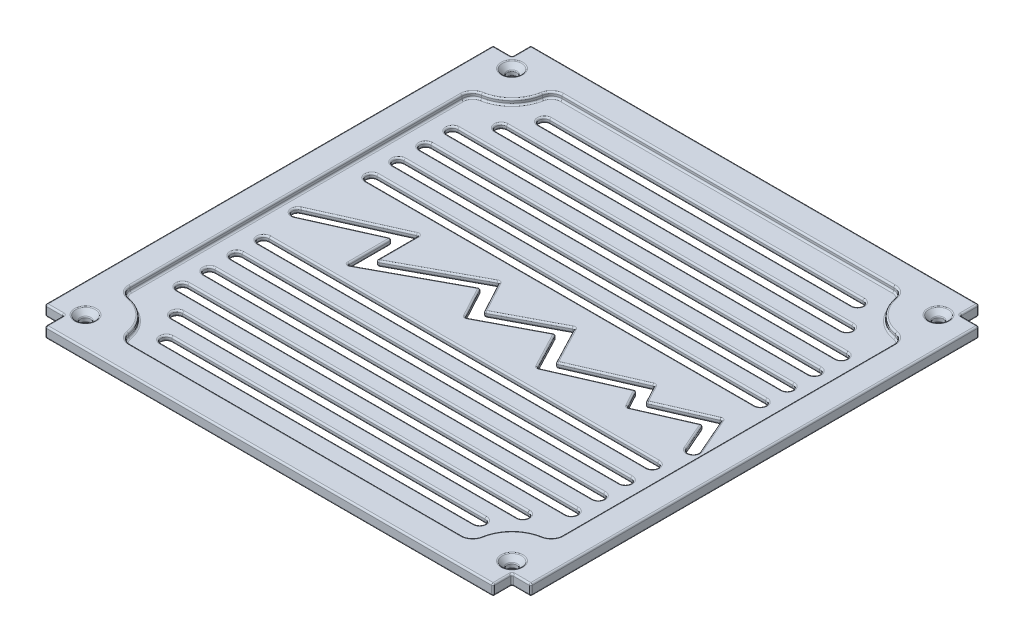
SolidWorks part; units mm, degrees
ref_plane "Front Plane" through (0, 0, 0) normal (0, 0, 1) x (1, 0, 0)
ref_plane "Top Plane" through (0, 0, 0) normal (0, 1, 0) x (1, 0, 0)
ref_plane "Right Plane" through (0, 0, 0) normal (1, 0, 0) x (0, 0, -1)
imported_body "Stock-cubesat - Master-1"
sketch "Sketch1" plane through (0, 50, 0) normal (0, 1, 0) x (1, 0, 0)
  line L1 (32.6181, -40) -> (-32.6181, -40)
  line L2 (40, -32.6181) -> (40, 32.6181)
  line L3 (32.6181, 40) -> (-32.6181, 40)
  line L4 (-40, -32.6181) -> (-40, 32.6181)
  line L5 (34.621, -34.621) -> (-34.621, 34.621) construction
  line L6 (34.621, 34.621) -> (-34.621, -34.621) construction
  arc A1 (32.6181, 40) -> (40, 32.6181) centre (39.5, 39.5) ccw
  circle A2 centre (-39.5, 39.5) radius 6.9
  arc A3 (-40, 32.6181) -> (-32.6181, 40) centre (-39.5, 39.5) ccw
  arc A4 (40, -32.6181) -> (32.6181, -40) centre (39.5, -39.5) ccw
  arc A5 (-32.6181, -40) -> (-40, -32.6181) centre (-39.5, -39.5) ccw
  point P0 (0, 0)
  point P18 (0, 0)
  dimension "D1" = 5
  dimension "D2" = 4
extrude "Cut-Extrude1" cut sketch "Sketch1" against normal blind 1
fillet "Fillet1" radius 2 8 edges at (-32.6181, 49.5, 40) (-40, 49.5, 32.6181) (40, 49.5, 32.6181) (32.6181, 49.5, 40) (40, 49.5, -32.6181) (32.6181, 49.5, -40) (-40, 49.5, -32.6181) (-32.6181, 49.5, -40)
sketch "Sketch2" plane through (0, 49, 0) normal (0, 1, 0) x (1, 0, 0)
  line L0 (0, 0) -> (-15.888, 0) construction
  line L1 (29, 35) -> (-29, 35) construction
  line L2 (29, 34) -> (-29, 34)
  line L3 (29, 36) -> (-29, 36)
  line L4 (32, 30) -> (-32, 30) construction
  line L5 (32, 29) -> (-32, 29)
  line L6 (32, 31) -> (-32, 31)
  line L7 (36, 25) -> (-36, 25) construction
  line L8 (36, 24) -> (-36, 24)
  line L9 (36, 26) -> (-36, 26)
  line L10 (36, 20) -> (-36, 20) construction
  line L11 (36, 19) -> (-36, 19)
  line L12 (36, 21) -> (-36, 21)
  line L13 (36, 15) -> (-36, 15) construction
  line L14 (36, 14) -> (-36, 14)
  line L15 (36, 16) -> (-36, 16)
  line L16 (36, 10) -> (-36, 10) construction
  line L17 (36, 9) -> (-36, 9)
  line L18 (36, 11) -> (-36, 11)
  line L19 (36, -10) -> (-36, -10) construction
  line L20 (36, -9) -> (-36, -9)
  line L21 (36, -11) -> (-36, -11)
  line L28 (36, -15) -> (-36, -15) construction
  line L29 (36, -14) -> (-36, -14)
  line L30 (36, -16) -> (-36, -16)
  line L31 (36, -20) -> (-36, -20) construction
  line L32 (36, -19) -> (-36, -19)
  line L33 (36, -21) -> (-36, -21)
  line L34 (36, -25) -> (-36, -25) construction
  line L35 (36, -24) -> (-36, -24)
  line L36 (36, -26) -> (-36, -26)
  line L37 (32, -30) -> (-32, -30) construction
  line L38 (32, -29) -> (-32, -29)
  line L39 (32, -31) -> (-32, -31)
  line L40 (29, -35) -> (-29, -35) construction
  line L41 (29, -34) -> (-29, -34)
  line L42 (29, -36) -> (-29, -36)
  line L43 (36, 5) -> (-36, 5) construction
  line L44 (36, 4) -> (-36, 4)
  line L45 (36, 6) -> (-36, 6)
  line L46 (36, 0) -> (-36, 0) construction
  line L47 (36, -1) -> (-36, -1)
  line L48 (36, 1) -> (-36, 1)
  line L49 (36, 5) -> (-36, 5) construction
  line L50 (36, 4) -> (-36, 4)
  line L51 (36, 6) -> (-36, 6)
  line L52 (36, 0) -> (-36, 0) construction
  line L53 (36, -1) -> (-36, -1)
  line L54 (36, 1) -> (-36, 1)
  arc A0 (29, 34) -> (29, 36) centre (29, 35) ccw
  arc A1 (-29, 36) -> (-29, 34) centre (-29, 35) ccw
  arc A2 (32, 29) -> (32, 31) centre (32, 30) ccw
  arc A3 (-32, 31) -> (-32, 29) centre (-32, 30) ccw
  arc A4 (36, 24) -> (36, 26) centre (36, 25) ccw
  arc A5 (-36, 26) -> (-36, 24) centre (-36, 25) ccw
  arc A6 (36, 19) -> (36, 21) centre (36, 20) ccw
  arc A7 (-36, 21) -> (-36, 19) centre (-36, 20) ccw
  arc A8 (36, 14) -> (36, 16) centre (36, 15) ccw
  arc A9 (-36, 16) -> (-36, 14) centre (-36, 15) ccw
  arc A10 (36, 9) -> (36, 11) centre (36, 10) ccw
  arc A11 (-36, 11) -> (-36, 9) centre (-36, 10) ccw
  arc A12 (36, -9) -> (36, -11) centre (36, -10) cw
  arc A13 (-36, -11) -> (-36, -9) centre (-36, -10) cw
  arc A18 (36, -14) -> (36, -16) centre (36, -15) cw
  arc A19 (-36, -16) -> (-36, -14) centre (-36, -15) cw
  arc A20 (36, -19) -> (36, -21) centre (36, -20) cw
  arc A21 (-36, -21) -> (-36, -19) centre (-36, -20) cw
  arc A22 (36, -24) -> (36, -26) centre (36, -25) cw
  arc A23 (-36, -26) -> (-36, -24) centre (-36, -25) cw
  arc A24 (32, -29) -> (32, -31) centre (32, -30) cw
  arc A25 (-32, -31) -> (-32, -29) centre (-32, -30) cw
  arc A26 (29, -34) -> (29, -36) centre (29, -35) cw
  arc A27 (-29, -36) -> (-29, -34) centre (-29, -35) cw
  arc A32 (36, 4) -> (36, 6) centre (36, 5) ccw
  arc A33 (-36, 6) -> (-36, 4) centre (-36, 5) ccw
  arc A34 (36, -1) -> (36, 1) centre (36, 0) ccw
  arc A35 (-36, 1) -> (-36, -1) centre (-36, 0) ccw
  point P4 (0, 35)
  point P12 (0, 30)
  point P19 (0, 25)
  point P27 (0, 20)
  point P34 (0, 15)
  point P41 (0, 10)
  point P48 (0, -10)
  point P55 (0, 5)
  point P61 (0, 0)
  point P69 (0, -15)
  point P76 (0, -20)
  point P83 (0, -25)
  point P90 (0, -30)
  point P97 (0, -35)
  point P104 (0, 5)
  point P111 (0, 0)
  point P118 (0, 5)
  point P125 (0, 0)
  dimension "D2" = 5
  dimension "D3" = 5
  dimension "D4" = 6
extrude "Cut-Extrude2" cut sketch "Sketch2" against normal blind 5
sketch "Sketch3" plane through (0, 49, 0) normal (0, 1, 0) x (1, 0, 0)
  line L0 (-37.2583, -2.3745) -> (-23.4027, 3.8135) construction
  line L1 (-23.4027, 3.8135) -> (-23.4027, -4.5814) construction
  line L2 (-23.4027, -4.5814) -> (-7.8904, 3.7953) construction
  line L3 (-7.8904, 3.7953) -> (-4.5587, -2.3745) construction
  line L4 (-4.5587, -2.3745) -> (6.4532, 3.4028) construction
  line L5 (6.4532, 3.4028) -> (10.245, -3.8245) construction
  line L6 (10.245, -3.8245) -> (22.987, 1.734) construction
  line L7 (22.987, 1.734) -> (24.9061, -1.8199) construction
  line L8 (24.9061, -1.8199) -> (34.6793, 2.4435) construction
  line L9 (34.6793, 2.4435) -> (37.4136, -3.8245) construction
  line L10 (-36.8505, -3.2876) -> (-24.4027, 2.2717)
  line L11 (-24.4027, 2.2717) -> (-24.4027, -6.2578)
  line L12 (-24.4027, -6.2578) -> (-8.2951, 2.4402)
  line L13 (-8.2951, 2.4402) -> (-4.9691, -3.7191)
  line L14 (-4.9691, -3.7191) -> (6.0323, 2.0527)
  line L15 (6.0323, 2.0527) -> (9.7918, -5.1132)
  line L16 (9.7918, -5.1132) -> (22.5441, 0.4497)
  line L17 (22.5441, 0.4497) -> (24.4631, -3.1041)
  line L18 (24.4631, -3.1041) -> (34.1625, 1.127)
  line L19 (34.1625, 1.127) -> (36.497, -4.2244)
  line L20 (-37.6661, -1.4614) -> (-22.4027, 5.3553)
  line L21 (-22.4027, 5.3553) -> (-22.4027, -2.9049)
  line L22 (-22.4027, -2.9049) -> (-7.4856, 5.1503)
  line L23 (-7.4856, 5.1503) -> (-4.1483, -1.0299)
  line L24 (-4.1483, -1.0299) -> (6.8742, 4.7529)
  line L25 (6.8742, 4.7529) -> (10.6981, -2.5358)
  line L26 (10.6981, -2.5358) -> (23.43, 3.0182)
  line L27 (23.43, 3.0182) -> (25.3491, -0.5356)
  line L28 (25.3491, -0.5356) -> (35.196, 3.7599)
  line L29 (35.196, 3.7599) -> (38.3301, -3.4247)
  arc A0 (-36.8505, -3.2876) -> (-37.6661, -1.4614) centre (-37.2583, -2.3745) cw
  arc A1 (36.497, -4.2244) -> (38.3301, -3.4247) centre (37.4136, -3.8245) ccw
  dimension "D1" = 1
  dimension "D2" = 1
extrude "Cut-Extrude3" cut sketch "Sketch3" against normal blind 5
fillet "Fillet2" radius 0.3 81 edges at (-32.0169, 50, -39.5288) (-39.5288, 50, -32.0169) (32.0169, 50, 39.5288) (39.5288, 50, 32.0169) (-32.0169, 50, 39.5288) (-39.5288, 49, 32.0169) (32.0169, 49, 39.5288) (-39.5, 49, -38.6) (39.5, 49, 40.4) (41.5, 49, -45) (-45, 49, -41.5) (-45, 49, 41.5) (41.5, 49, 41.5) (-43.25, 50, -41.5) (0, 48, -45) (41.5, 48, -43.25) (43.25, 48, 41.5) (-39.5, 48, -38.6) (40, 49, 0) (0, 49, 40) (-34.621, 49, 34.621) (-40, 49, 0) (40, 50, 0) (34.621, 50, 34.621) (0, 50, 40) (-34.621, 50, 34.621) (0, 49, -34) (-30, 49, -35) (30, 49, -35) (0, 48, -24) (0, 48, -26) (0, 49, -24) (-37, 49, -25) (37, 49, -25) (0, 48, -21) (0, 48, -14) (-37, 48, -15) (0, 49, -14) (37, 49, -15) (0, 48, -9) (-37, 48, -10) (0, 48, -11) (-37, 48, 10) (0, 49, 11) (-37, 49, 10) (0, 48, 19) (0, 49, 19) (-37, 48, 25) (0, 48, 24) (0, 49, 26) (-37, 49, 25) (0, 48, 29) (0, 49, 29) (0, 49, 34) (-38.1713, 48, 2.7823) (-30.0344, 48, -1.947) (-22.4027, 48, -1.2252) (8.7861, 48, -1.1085) (17.0641, 48, -0.2412) (24.3896, 48, -1.2413) (35.3298, 48, 1.5487) (23.5036, 48, 1.3272) (7.912, 48, 1.5303) (-30.6266, 48, 0.5079) (-22.4027, 48.5, -5.3553) (-7.4856, 48.5, -5.1503) (-4.1483, 48.5, 1.0299) (10.6981, 48.5, 2.5358) (35.196, 48.5, -3.7599) (34.1625, 48.5, -1.127) (24.4631, 48.5, 3.1041) (-4.9691, 48.5, 3.7191) (1.3629, 49, -1.8615) (24.3896, 49, -1.2413) (30.2726, 49, -1.6121) (35.3298, 49, 1.5487) (29.3128, 49, 0.9886) (16.1679, 49, 2.3318) (-6.6321, 49, 0.6394) (-16.3489, 49, 1.9088) (-38.1713, 49, 2.7823)
